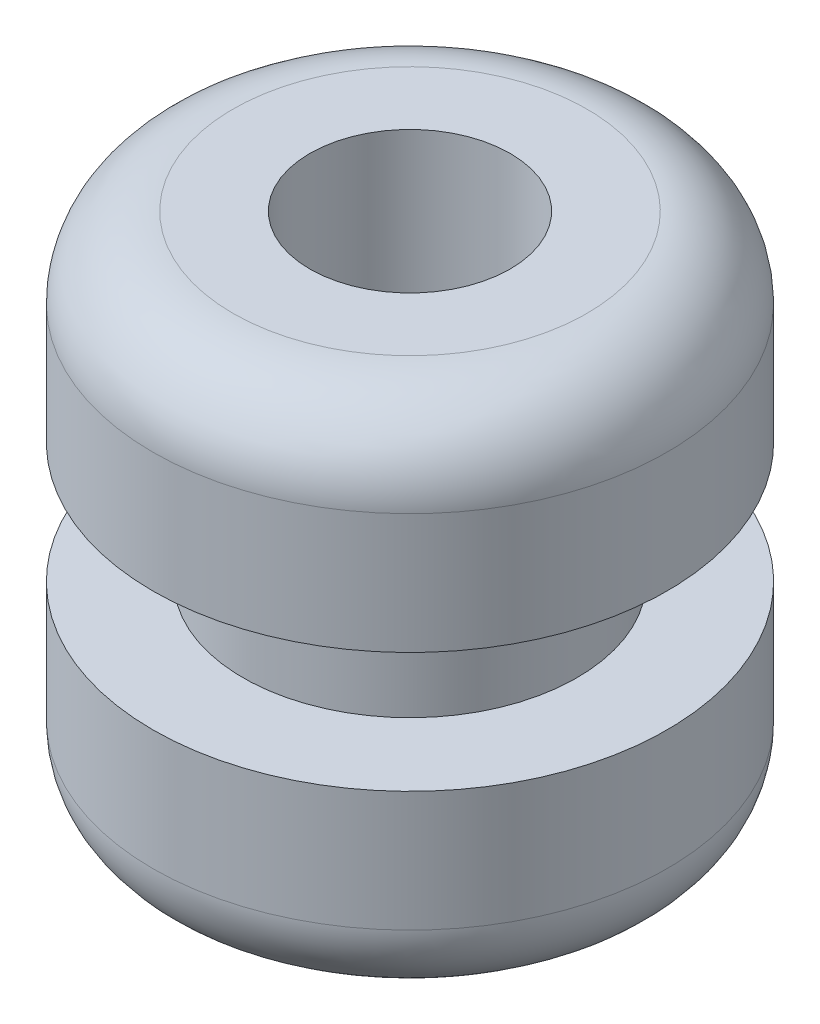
SolidWorks part; units mm, degrees
ref_plane "Front Plane" through (0, 0, 0) normal (0, 0, 1) x (1, 0, 0)
ref_plane "Top Plane" through (0, 0, 0) normal (0, 1, 0) x (1, 0, 0)
ref_plane "Right Plane" through (0, 0, 0) normal (1, 0, 0) x (0, 0, -1)
sketch "Sketch1" plane through (0, 0, 0) normal (1, 0, 0) x (0, 0, -1)
  line L0 (0, 0) -> (0, 74.0417) construction
  line L1 (3.175, 0) -> (4.8895, 0)
  line L2 (4.8895, 0) -> (4.8895, -3.81)
  line L3 (4.8895, -3.81) -> (0, -3.81)
  line L4 (3.175, 0) -> (3.175, 2.286)
  line L5 (3.175, 2.286) -> (4.8895, 2.286)
  line L6 (4.8895, 2.286) -> (4.8895, 6.096)
  line L7 (4.8895, 6.096) -> (0, 6.096)
  line L8 (0, 6.096) -> (0, -3.81)
  dimension "D1" = 6.35
  dimension "D2" = 2.286
  dimension "D3" = 3.81
  dimension "D4" = 9.779
revolve "Revolve1" add sketch "Sketch1" angle 360 about L0
fillet "Fillet1" radius 1.524 2 edges at (0, -3.81, -4.8895) (0, 6.096, -4.8895)
sketch "Sketch2" plane through (0, 6.096, 0) normal (0, 1, 0) x (1, 0, 0)
  circle A0 centre (0, 0) radius 1.905
  dimension "D1" = 3.81
extrude "Cut-Extrude1" cut sketch "Sketch2" against normal through all
